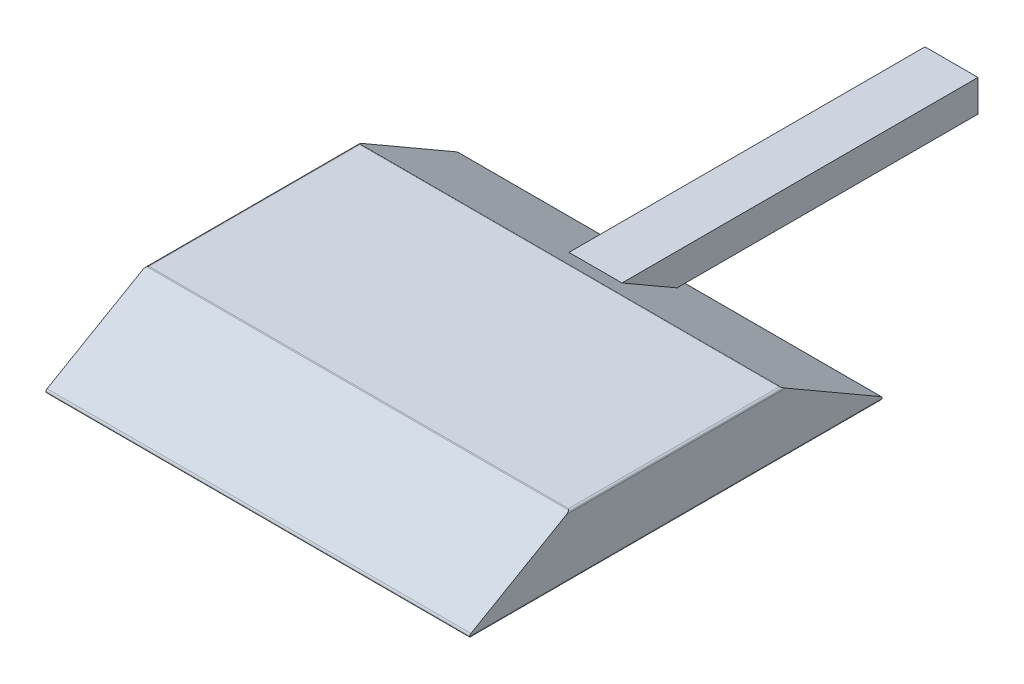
SolidWorks part; units mm, degrees
ref_plane "Front Plane" through (0, 0, 0) normal (0, 0, 1) x (1, 0, 0)
ref_plane "Top Plane" through (0, 0, 0) normal (0, 1, 0) x (1, 0, 0)
ref_plane "Right Plane" through (0, 0, 0) normal (1, 0, 0) x (0, 0, -1)
sketch "Sketch1" plane through (0, 0, 0) normal (1, 0, 0) x (0, 0, -1)
  line L0 (25.4, -3.6662) -> (-25.4, -3.6662)
  line L1 (-25.4, -3.6662) -> (-12.7, 3.6662)
  line L2 (-12.7, 3.6662) -> (12.7, 3.6662)
  line L3 (12.7, 3.6662) -> (25.4, -3.6662)
  line L4 (0, -3.6662) -> (0, 3.6662) construction
  point P6 (0, 0)
  dimension "D1" = 30
  dimension "D2" = 25.4
  dimension "D3" = 50.8
extrude "Boss-Extrude1" add sketch "Sketch1" along normal mid plane 50.8
ref_plane "Plane1" through (0, 0, -12.7) normal (0, 0, -1) x (-1, 0, 0)
sketch "Sketch2" plane through (0, 0, -12.7) normal (0, 0, -1) x (-1, 0, 0)
  line L1 (-3.175, 1.905) -> (3.175, 1.905)
  line L2 (-3.175, 1.905) -> (-3.175, -1.905)
  line L3 (-3.175, -1.905) -> (3.175, -1.905)
  line L4 (3.175, 1.905) -> (3.175, -1.905)
  line L5 (-3.175, 1.905) -> (3.175, -1.905) construction
  line L6 (-3.175, -1.905) -> (3.175, 1.905) construction
  point P0 (0, 0)
  dimension "D1" = 6.35
  dimension "D2" = 3.81
extrude "Boss-Extrude2" add sketch "Sketch2" along normal blind 45.72
fillet "Fillet1" radius 0.254 8 edges at (25.4, 3.6662, 0) (0, 3.6662, 12.7) (0, 3.6662, -12.7) (-25.4, 3.6662, 0) (-25.4, -3.6662, 0) (0, -3.6662, -25.4) (25.4, -3.6662, 0) (0, -3.6662, 25.4)
